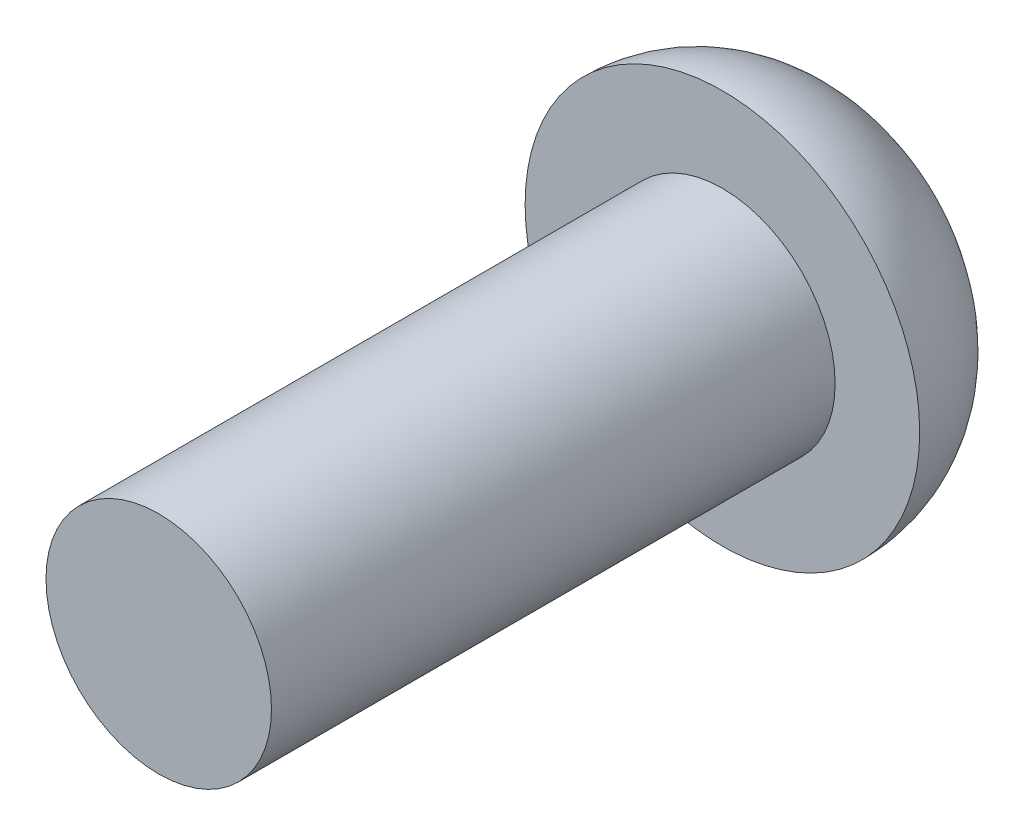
SolidWorks part; units mm, degrees
ref_plane "Alzado" through (0, 0, 0) normal (0, 0, 1) x (1, 0, 0)
ref_plane "Planta" through (0, 0, 0) normal (0, 1, 0) x (1, 0, 0)
ref_plane "Vista lateral" through (0, 0, 0) normal (1, 0, 0) x (0, 0, -1)
sketch "Croquis1" plane through (0, 0, 0) normal (0, 0, 1) x (1, 0, 0)
  circle A0 centre (0, 0) radius 7
extrude "Extruir1" add sketch "Croquis1" along normal blind 5
sketch "Croquis2" plane through (0, 0, 5) normal (0, 0, 1) x (1, 0, 0)
  circle A0 centre (0, 0) radius 4
extrude "Extruir2" add sketch "Croquis2" along normal blind 20
fillet "Redondeo2" radius 5 1 edges at (7, 0, 0)
